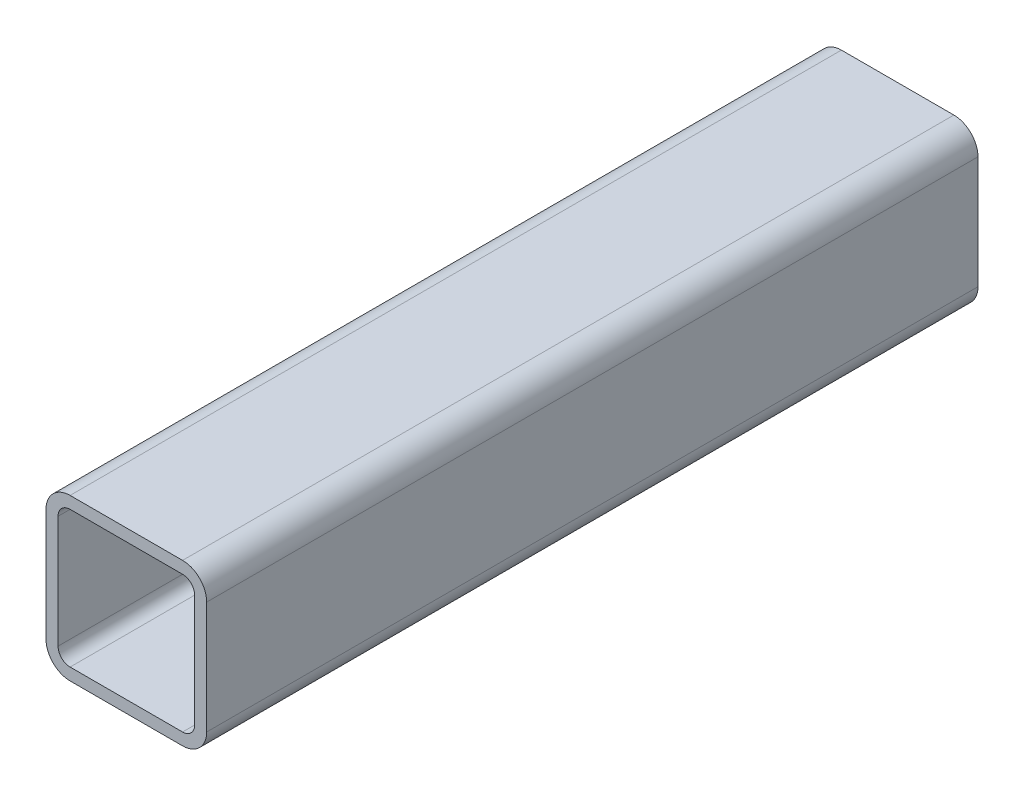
SolidWorks part; units mm, degrees
ref_plane "Front Plane" through (0, 0, 0) normal (0, 0, 1) x (1, 0, 0)
ref_plane "Top Plane" through (0, 0, 0) normal (0, 1, 0) x (1, 0, 0)
ref_plane "Right Plane" through (0, 0, 0) normal (1, 0, 0) x (0, 0, -1)
sketch "Sketch1" plane through (0, 0, 0) normal (0, 0, 1) x (1, 0, 0)
sketch_block_instance "HSS2.5x2.5x0.1875-1"
sketch_block "HSS2.5x2.5x0.1875"
extrude "Boss-Extrude1" add sketch "Sketch1" along normal blind 304.8
